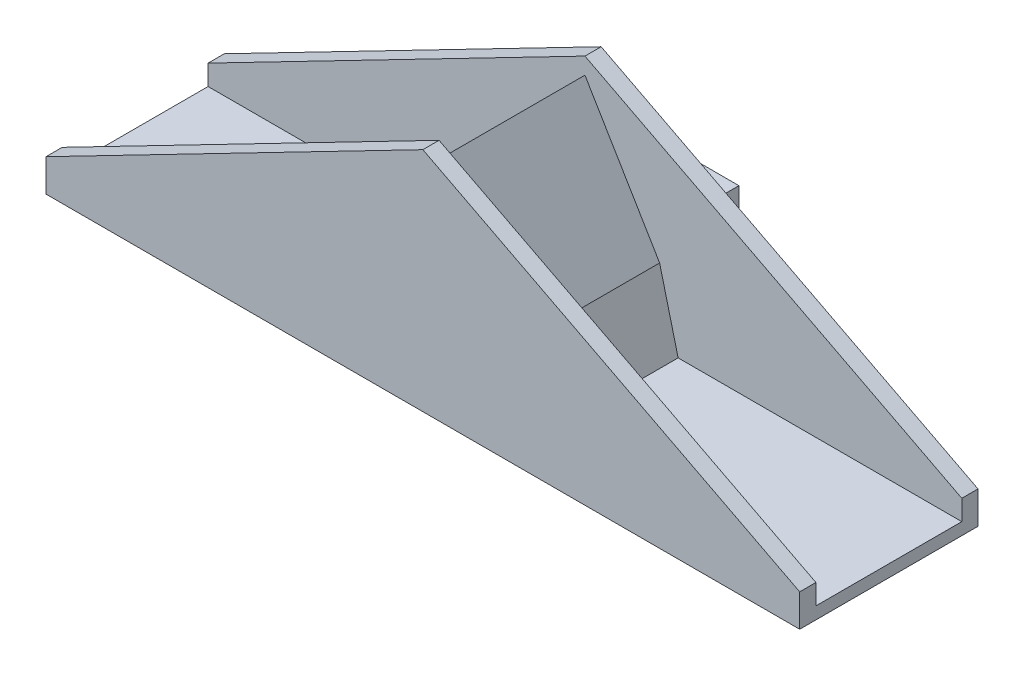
SolidWorks part; units mm, degrees
ref_plane "Plan de face" through (0, 0, 0) normal (0, 0, 1) x (1, 0, 0)
ref_plane "Plan de dessus" through (0, 0, 0) normal (0, 1, 0) x (1, 0, 0)
ref_plane "Plan de droite" through (0, 0, 0) normal (1, 0, 0) x (0, 0, -1)
sketch "Esquisse1" plane through (0, 0, 0) normal (0, 0, 1) x (1, 0, 0)
  line L0 (-33.7291, -2.6163) -> (59.2709, -2.6163)
  line L1 (12.7709, -2.6163) -> (12.7709, 41.3372) construction
  line L2 (-33.7291, -2.6163) -> (-33.7291, 1.3837)
  line L3 (-33.7291, 1.3837) -> (12.7709, 25.3837)
  line L4 (59.2709, -2.6163) -> (59.2709, 1.3837)
  line L5 (59.2709, 1.3837) -> (12.7709, 25.3837)
  dimension "D1" = 93
  dimension "D2" = 4
  dimension "D3" = 28
  dimension "D4" = 4
extrude "Boss.-Extru.1" add sketch "Esquisse1" along normal blind 2
sketch "Esquisse2" plane through (0, 0, 0) normal (0, 0, -1) x (-1, 0, 0)
  line L1 (-59.2709, -2.6163) -> (33.7291, -2.6163)
  line L2 (-59.2709, -2.6163) -> (-59.2709, -1.1163)
  line L3 (-59.2709, -1.1163) -> (33.7291, -1.1163)
  line L4 (33.7291, -2.6163) -> (33.7291, -1.1163)
  dimension "D1" = 1.5
extrude "Boss.-Extru.2" add sketch "Esquisse2" along normal blind 9
sketch "Esquisse3" plane through (0, 0, 0) normal (0, 0, -1) x (-1, 0, 0)
  line L0 (-12.7709, 25.3837) -> (-12.7709, -1.1163) construction
  line L1 (33.7291, -1.1163) -> (-59.2709, -1.1163) construction
  line L2 (-24.2709, -1.1163) -> (-21.986, 7.8837)
  line L3 (-21.986, 7.8837) -> (-12.7709, 23.346)
  line L4 (-24.2709, -1.1163) -> (-1.2709, -1.1163)
  line L6 (-1.2709, -1.1163) -> (-3.5558, 7.8837)
  line L7 (-3.5558, 7.8837) -> (-12.7709, 23.346)
  dimension "D1" = 11.5
  dimension "D2" = 18
  dimension "D3" = 9
extrude "Boss.-Extru.3" add sketch "Esquisse3" along normal blind 9
sketch "Esquisse7" plane through (0, 0, -9) normal (0, 0, -1) x (-1, 0, 0)
  line L0 (-12.7709, -2.6163) -> (-12.7709, 23.346) construction
  line L1 (-59.2709, -2.6163) -> (33.7291, -2.6163) construction
  line L2 (-12.7709, 4.3837) -> (-1.2275, -2.6163)
  line L3 (-1.2275, -2.6163) -> (-24.3143, -2.6163)
  line L4 (-12.7709, 4.3837) -> (-24.3143, -2.6163)
  dimension "D1" = 7
  dimension "D2" = 13.5
extrude "Enlèv. mat.-Extru.3" cut sketch "Esquisse7" against normal blind 9
sketch "Esquisse8" plane through (0, 0, 0) normal (0, 0, -1) x (-1, 0, 0)
  line L0 (-12.7709, 4.3837) -> (-12.7709, -2.6163) construction
  line L1 (-24.3143, -2.6163) -> (-1.2275, -2.6163) construction
  line L2 (-13.2709, -2.6163) -> (-12.2709, -2.6163)
  line L3 (-12.2709, -2.6163) -> (-11.7709, 4.3837)
  line L4 (-11.7709, 4.3837) -> (-13.7709, 4.3837)
  line L5 (-13.2709, -2.6163) -> (-13.7709, 4.3837)
  point P5 (-12.7709, 4.3192)
  dimension "D1" = 1
  dimension "D2" = 0.5
extrude "Boss.-Extru.5" add sketch "Esquisse8" along normal blind 9
sketch "Esquisse9" plane through (0, 0, -9) normal (0, 0, -1) x (-1, 0, 0)
  line L0 (-12.7709, 23.346) -> (-12.7709, 3.6186) construction
  line L1 (-12.7709, 21.3927) -> (-21.0525, 7.4967)
  line L2 (-21.0525, 7.4967) -> (-23.1427, -0.7363)
  line L3 (-23.1427, -0.7363) -> (-12.7709, 5.5532)
  line L4 (-12.7709, 23.346) -> (-21.986, 7.8837) construction
  line L5 (-21.986, 7.8837) -> (-24.2709, -1.1163) construction
  line L6 (-13.7294, 3.8025) -> (-24.3143, -2.6163) construction
  line L7 (-2.3991, -0.7363) -> (-12.7709, 5.5532)
  line L8 (-4.4892, 7.4967) -> (-2.3991, -0.7363)
  line L9 (-12.7709, 21.3927) -> (-4.4892, 7.4967)
  dimension "D1" = 1
  dimension "D2" = 1
  dimension "D3" = 1
extrude "Enlèv. mat.-Extru.5" cut sketch "Esquisse9" against normal blind 9
mirror "Symétrie11" about plane through (0, 0, -9) normal (0, 0, 1) of "Boss.-Extru.1", "Boss.-Extru.3", "Boss.-Extru.5", "Enlèv. mat.-Extru.5", "Boss.-Extru.2", "Enlèv. mat.-Extru.3"
pattern_linear "Répétition linéaire1" count 5 spacing 20 along (0, 0, -1) of "Boss.-Extru.1"
sketch "Esquisse10" plane through (0, 0, -20) normal (0, 0, -1) x (-1, 0, 0)
  line L0 (-12.7709, 25.3837) -> (-12.7709, -2.6163) construction
  line L1 (33.7291, -2.6163) -> (-59.2709, -2.6163) construction
  line L3 (-26.7709, 16.0394) -> (-17.7709, 16.0394)
  line L4 (-26.7709, 16.0394) -> (-26.7709, 8.0394)
  line L5 (-26.7709, 8.0394) -> (-17.7709, 8.0394)
  line L6 (-17.7709, 16.0394) -> (-17.7709, 8.0394)
  dimension "D1" = 5
  dimension "D2" = 9
  dimension "D3" = 8
extrude "Boss.-Extru.6" add sketch "Esquisse10" along normal blind 3
fillet "Congé1" radius 1 3 edges at (17.7709, 12.0394, -20) (22.2709, 8.0394, -20) (26.7709, 12.0394, -20)
sketch "Esquisse11" plane through (0, 16.0394, 0) normal (0, 1, 0) x (1, 0, 0)
  line L0 (16.7709, 20) -> (27.7709, 20) construction
  line L1 (24.7709, 20) -> (19.7709, 20)
  line L2 (24.7709, 20) -> (24.7709, 22)
  line L3 (24.7709, 22) -> (19.7709, 22)
  line L4 (19.7709, 20) -> (19.7709, 22)
  line L5 (17.7709, 23) -> (17.7709, 21) construction
  point P6 (24.7709, 21)
  dimension "D1" = 5
  dimension "D2" = 2
  dimension "D3" = 2
extrude "Enlèv. mat.-Extru.6" cut sketch "Esquisse11" against normal blind 9
